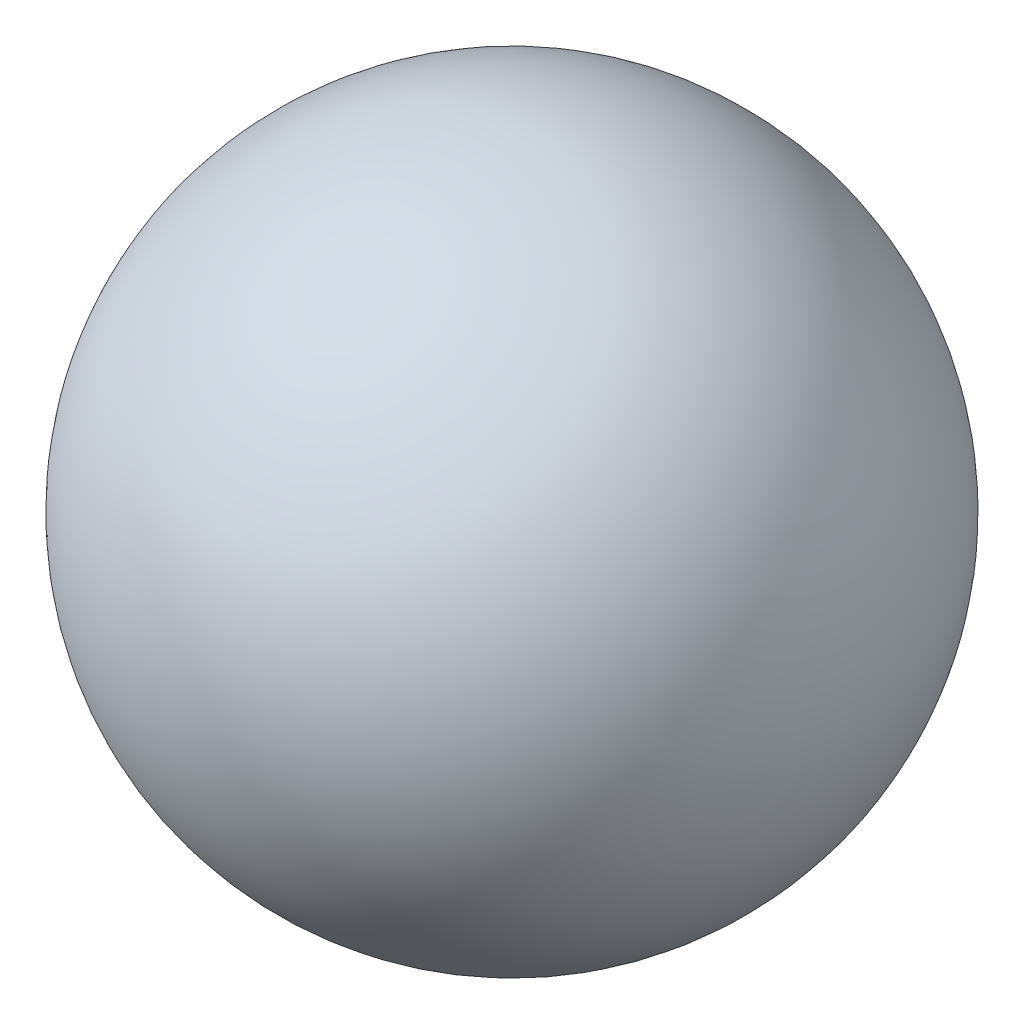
SolidWorks part; units mm, degrees
ref_plane "Plan1" through (0, 0, 0) normal (0, 0, 1) x (1, 0, 0)
ref_plane "Plan2" through (0, 0, 0) normal (0, 1, 0) x (1, 0, 0)
ref_plane "Plan3" through (0, 0, 0) normal (1, 0, 0) x (0, 0, -1)
sketch "Esquisse1" plane through (0, 0, 0) normal (0, 0, 1) x (1, 0, 0)
  line L0 (0.75, 10) -> (6.75, 10)
  line L1 (-1.3797, 10) -> (7.6349, 10) construction
  arc A0 (0.75, 10) -> (6.75, 10) centre (3.75, 10) ccw
  arc A1 (1.1519, 8.5) -> (6.3481, 8.5) centre (3.75, 10) ccw construction
revolve "Base-Révolution" add sketch "Esquisse1" angle 360 about L1
sketch "Esquisse2" plane through (0, 0, 0) normal (0, 0, 1) x (1, 0, 0)
  line L0 (0, 0) -> (10, 0) construction
sketch "Esq_WRNL_Compact001" plane through (0, 0, 0) normal (0, 0, 1) x (1, 0, 0)
  line L0 (-1, -1) -> (-1, 14)
  line L1 (11, -1) -> (11, 14)
  line L2 (-1, -1) -> (11, -1)
  line L3 (-1, 14) -> (11, 14)
